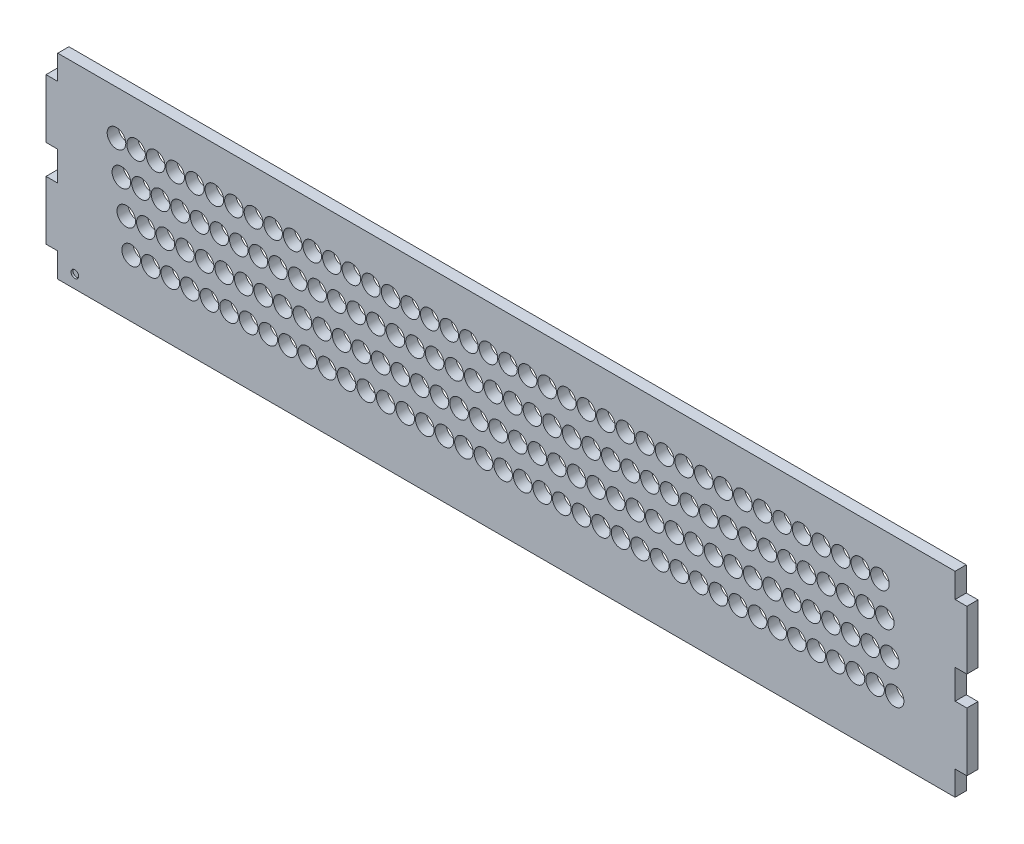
SolidWorks part; units mm, degrees
ref_plane "Alzado" through (0, 0, 0) normal (0, 0, 1) x (1, 0, 0)
ref_plane "Planta" through (0, 0, 0) normal (0, 1, 0) x (1, 0, 0)
ref_plane "Vista lateral" through (0, 0, 0) normal (1, 0, 0) x (0, 0, -1)
sketch "Croquis1" plane through (0, 0, 0) normal (0, 0, 1) x (1, 0, 0)
  line L1 (-229.2, -50) -> (229.2, -50)
  line L2 (-229.2, -50) -> (-229.2, 50)
  line L3 (-229.2, 50) -> (229.2, 50)
  line L4 (229.2, -50) -> (229.2, 50)
  line L5 (-229.2, -50) -> (229.2, 50) construction
  line L6 (-229.2, 50) -> (229.2, -50) construction
  point P0 (0, 0)
  dimension "D1" = 100
  dimension "D2" = 458.4
extrude "Saliente-Extruir1" add sketch "Croquis1" along normal blind 5.7
sketch "Croquis2" plane through (-229.2, 0, 0) normal (-1, 0, 0) x (0, 0, 1)
  line L0 (5.7, 50) -> (5.7, -50) construction
  line L1 (5.7, 37.5) -> (0, 37.5)
  line L2 (5.7, 37.5) -> (5.7, 7.5)
  line L3 (5.7, 7.5) -> (0, 7.5)
  line L4 (0, 37.5) -> (0, 7.5)
  line L5 (0, 50) -> (0, -50) construction
  line L6 (0, 7.5) -> (0, -7.5) construction
  line L7 (5.7, -7.5) -> (0, -7.5)
  line L8 (5.7, -7.5) -> (5.7, -37.5)
  line L9 (5.7, -37.5) -> (0, -37.5)
  line L10 (0, -7.5) -> (0, -37.5)
  point P12 (0, 0)
  point P13 (0, 22.5)
  point P15 (0, -22.5)
  dimension "D1" = 30
  dimension "D2" = 30
  dimension "D3" = 45
extrude "Saliente-Extruir2" add sketch "Croquis2" along normal blind 6
sketch "Croquis3" plane through (229.2, 0, 0) normal (1, 0, 0) x (0, 0, -1)
  line L0 (-5.7, -50) -> (-5.7, 50) construction
  line L1 (-5.7, -37.5) -> (0, -37.5)
  line L2 (-5.7, -37.5) -> (-5.7, -7.5)
  line L3 (-5.7, -7.5) -> (0, -7.5)
  line L4 (0, -37.5) -> (0, -7.5)
  line L5 (0, -50) -> (0, 50) construction
  line L6 (0, -7.5) -> (0, 7.5) construction
  line L7 (-5.7, 7.5) -> (0, 7.5)
  line L8 (-5.7, 7.5) -> (-5.7, 37.5)
  line L9 (-5.7, 37.5) -> (0, 37.5)
  line L10 (0, 7.5) -> (0, 37.5)
  point P12 (0, 0)
  point P13 (0, -22.5)
  point P15 (0, 22.5)
  dimension "D1" = 30
  dimension "D2" = 30
  dimension "D3" = 45
extrude "Saliente-Extruir3" add sketch "Croquis3" along normal blind 6
sketch "Croquis4" plane through (0, 0, 5.7) normal (0, 0, 1) x (1, 0, 0)
  line L0 (-229.2, 50) -> (-229.2, 37.5) construction
  line L1 (229.2, 50) -> (-229.2, 50) construction
  circle A0 centre (-199.2, 27.4) radius 4.75
  circle A1 centre (-196.7, 11.4) radius 4.75
  circle A2 centre (-194.2, -4.6) radius 4.75
  circle A3 centre (-191.7, -20.6) radius 4.75
  dimension "D1" = 9.5
  dimension "D2" = 9.5
  dimension "D3" = 9.5
  dimension "D4" = 9.5
  dimension "D7" = 2.5
  dimension "D8" = 16
  dimension "D9" = 2.5
  dimension "D10" = 16
  dimension "D11" = 16
  dimension "D12" = 2.5
  dimension "D5" = 30
  dimension "D6" = 22.6
extrude "Cortar-Extruir1" cut sketch "Croquis4" against normal up to next
pattern_linear "MatrizL1" count 40 spacing 10 along (1, 0, 0) of "Cortar-Extruir1"
sketch "Croquis5" plane through (0, 0, 5.7) normal (0, 0, 1) x (1, 0, 0)
  circle A0 centre (-220.4784, -43.3748) radius 1.9347
extrude "Cortar-Extruir2" cut sketch "Croquis5" against normal blind 1
